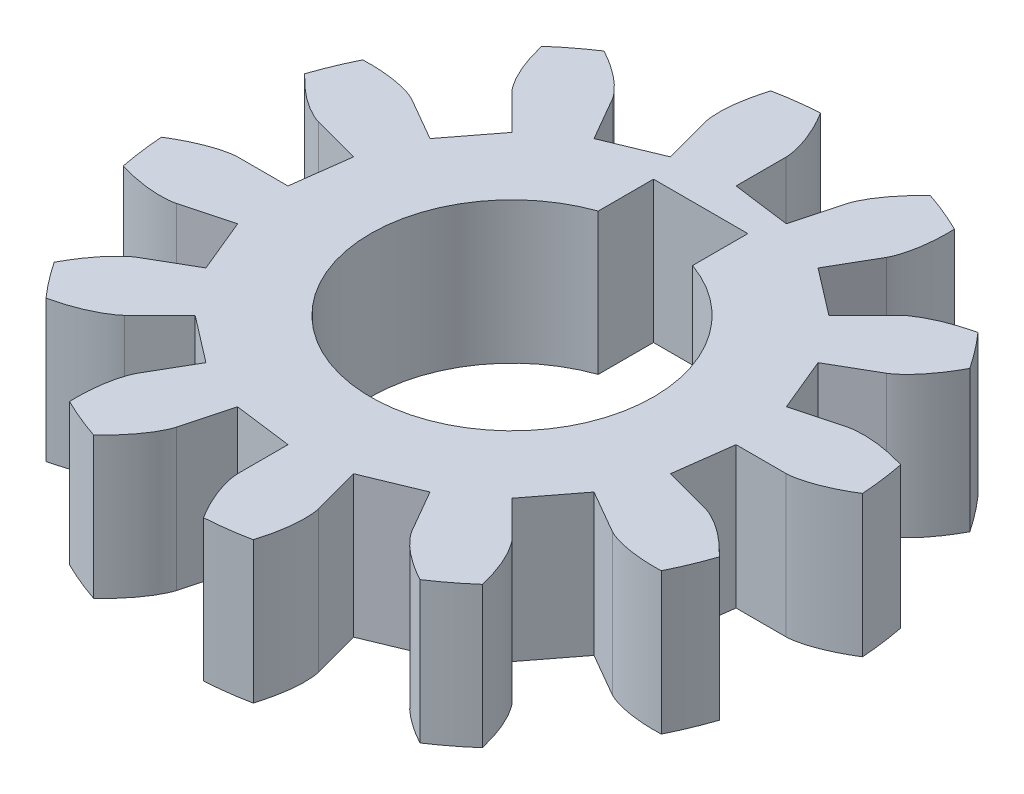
SolidWorks part; units mm, degrees
ref_plane "Front Plane" through (0, 0, 0) normal (0, 0, 1) x (1, 0, 0)
ref_plane "Top Plane" through (0, 0, 0) normal (0, 1, 0) x (1, 0, 0)
ref_plane "Right Plane" through (0, 0, 0) normal (1, 0, 0) x (0, 0, -1)
sketch "Sketch1" plane through (0, 0, 0) normal (0, 1, 0) x (1, 0, 0)
  line L0 (0, 0) -> (0, 2.9044) construction
  line L1 (0, 0) -> (-2.9044, 0) construction
  line L2 (0, 0) -> (-3.4701, -0.4568) construction
  line L3 (0, 0) -> (-2.8055, -0.7517) construction
  line L4 (0, 0) -> (-2.5153, -1.4522) construction
  circle A0 centre (0, 0) radius 3 construction
  circle A1 centre (0, 0) radius 2.9044 construction
  circle A2 centre (0, 0) radius 2.375 construction
  circle A3 centre (0, 0) radius 3.5 construction
  spline S0 degree 4 poles (-2.9044, 0) (-2.9111, 0) (-2.9296, -0.0007) (-2.9646, -0.0047) (-3.0211, -0.0149) (-3.0921, -0.0335) (-3.1821, -0.0638) (-3.2854, -0.1073) (-3.3957, -0.1631) (-3.5114, -0.2321) (-3.6229, -0.3081) (-3.7298, -0.3904) (-3.8324, -0.4779) (-3.9515, -0.5902) (-4.0871, -0.7336) (-4.2339, -0.9127) (-4.3862, -1.1288) (-4.525, -1.3614) (-4.6478, -1.5999) (-4.7551, -1.8504) (-4.847, -2.0993) (-4.9245, -2.3655) (-4.9869, -2.6153) (-5.0364, -2.9014) (-5.0704, -3.1344) (-5.0931, -3.4466) (-5.0999, -3.6323) (-5.1001, -3.8507) (-5.0962, -3.9482) (-5.0939, -4.0081) knots 0 0 0 0 0 0.005377 0.015084 0.028532 0.04661 0.064855 0.092111 0.119476 0.146842 0.174209 0.201575 0.228941 0.256307 0.307035 0.361767 0.4165 0.471232 0.525964 0.580697 0.635429 0.690161 0.744894 0.799626 0.854358 0.909091 0.954545 1 1 1 1 1 construction
  spline S1 degree 4 poles (-2.9044, 0) (-2.9111, 0) (-2.9296, -0.0007) (-2.9646, -0.0047) (-3.0211, -0.0149) (-3.0921, -0.0335) (-3.1821, -0.0638) (-3.2854, -0.1073) (-3.3957, -0.1631) (-3.5114, -0.2321) (-3.6229, -0.3081) (-3.7298, -0.3904) (-3.8324, -0.4779) (-3.9515, -0.5902) (-4.0871, -0.7336) (-4.2339, -0.9127) (-4.3862, -1.1288) (-4.525, -1.3614) (-4.6478, -1.5999) (-4.7551, -1.8504) (-4.847, -2.0993) (-4.9245, -2.3655) (-4.9869, -2.6153) (-5.0364, -2.9014) (-5.0704, -3.1344) (-5.0882, -3.3789) (-5.0943, -3.4984) (-5.0963, -3.5597) knots 0 0 0 0 0 0.005377 0.015084 0.028532 0.04661 0.064855 0.092111 0.119476 0.146842 0.174209 0.201575 0.228941 0.256307 0.307035 0.361767 0.4165 0.471232 0.525964 0.580697 0.635429 0.690161 0.744894 0.799626 0.854358 0.909091 0.909091 0.909091 0.909091 0.909091
  dimension "D1" = 7
  dimension "D2" = 6
  dimension "D3" = 5.8089
  dimension "D4" = 4.75
  dimension "D5" = 2.9044
  dimension "D6" = 7.5
  dimension "D7" = 15
  dimension "D8" = 30
sketch "Sketch2" plane through (0, 0, 0) normal (0, 1, 0) x (1, 0, 0)
  line L0 (0, 0) -> (-3.4701, -0.4568) construction
  line L1 (0, 0) -> (-3.4701, -0.4568) construction
  line L2 (0, 0) -> (-2.8055, -0.7517) construction
  line L3 (0, 0) -> (-2.9044, 0) construction
  line L4 (0, 0) -> (-2.5153, -1.4522) construction
  line L5 (0, 0) -> (-2.8055, -0.7517) construction
  line L6 (0, 0) -> (-2.9044, 0) construction
  line L7 (0, 0) -> (-2.5153, -1.4522) construction
  line L8 (-2.8055, -0.7517) -> (-2.2941, -0.6147)
  line L9 (-2.2941, -0.6147) -> (-2.0568, -1.1875)
  line L10 (-2.0568, -1.1875) -> (-2.5153, -1.4522) construction
  line L11 (-2.0568, -1.1875) -> (-1.299, -0.75)
  line L12 (-2.9044, 0) -> (-1.5, 0)
  circle A0 centre (0, 0) radius 2.375 construction
  circle A1 centre (0, 0) radius 2.9044 construction
  circle A2 centre (0, 0) radius 3 construction
  circle A3 centre (0, 0) radius 3.5 construction
  circle A4 centre (0, 0) radius 2.375 construction
  circle A5 centre (0, 0) radius 2.9044 construction
  circle A6 centre (0, 0) radius 3 construction
  circle A7 centre (0, 0) radius 3.5 construction
  arc A8 (-3.4315, -0.6892) -> (-3.4929, -0.2224) centre (0, 0) cw
  circle A11 centre (0, 0) radius 1.5 construction
  arc A12 (-1.5, 0) -> (-1.299, -0.75) centre (0, 0) ccw
  spline S0 degree 4 poles (-34.1117, -999.5091) (-1.7323, -18.0791) (-1.8596, -0.3555) (-2.4728, 0.0848) (-3.0211, -0.0149) (-3.0921, -0.0335) (-3.1821, -0.0638) (-3.2854, -0.1073) (-3.3957, -0.1631) (-3.5114, -0.2321) (-3.6229, -0.3081) (-3.7298, -0.3904) (-3.8324, -0.4779) (-3.9515, -0.5902) (-4.0871, -0.7336) (-4.2339, -0.9127) (-4.3862, -1.1288) (-4.525, -1.3614) (-4.6478, -1.5999) (-4.7551, -1.8504) (-4.847, -2.0993) (-4.9245, -2.3655) (-4.9869, -2.6153) (-5.0364, -2.9014) (-5.1901, -3.9552) (-5.0858, -7.216) (-3.5431, 26.5273) (-37.2414, -1003.0309) knots -0.405639 -0.405639 -0.405639 -0.405639 -0.405639 0.005377 0.015084 0.028532 0.04661 0.064855 0.092111 0.119476 0.146842 0.174209 0.201575 0.228941 0.256307 0.307035 0.361767 0.4165 0.471232 0.525964 0.580697 0.635429 0.690161 0.744894 0.799626 0.854358 1.680403 1.680403 1.680403 1.680403 1.680403 only from (-2.9044, 0) to (-5.0963, -3.5597) construction
  spline S1 degree 4 poles (-2.9044, 0) (-2.9111, 0) (-2.9296, -0.0007) (-2.9646, -0.0047) (-3.0211, -0.0149) (-3.0921, -0.0335) (-3.1821, -0.0638) (-3.2854, -0.1073) (-3.376, -0.1531) (-3.4444, -0.1925) (-3.483, -0.2163) (-3.4929, -0.2224) knots 0 0 0 0 0 0.005377 0.015084 0.028532 0.04661 0.064855 0.092111 0.119476 0.128939 0.128939 0.128939 0.128939 0.128939
  spline S2 degree 4 poles (-2.8055, -0.7517) (-2.8119, -0.7534) (-2.83, -0.7576) (-2.8648, -0.7628) (-2.922, -0.7675) (-2.9954, -0.7679) (-3.0901, -0.7619) (-3.2012, -0.7467) (-3.3006, -0.7259) (-3.3769, -0.7055) (-3.4203, -0.6926) (-3.4315, -0.6892) knots 0 0 0 0 0 0.005377 0.015084 0.028532 0.04661 0.064855 0.092111 0.119476 0.128939 0.128939 0.128939 0.128939 0.128939
  point P21 (-2.2941, -0.6147)
  point P24 (-2.0568, -1.1875)
  dimension "D2" = 3
extrude "Boss-Extrude1" add sketch "Sketch2" along normal blind 1.5
pattern_circular "CirPattern1" count 12 over 360 of "Boss-Extrude1"
sketch "Sketch3" plane through (0, 1.5, 0) normal (0, 1, 0) x (1, 0, 0)
  line L1 (0.5, 1) -> (-0.5, 1)
  line L2 (0.5, 1) -> (0.5, 2)
  line L3 (0.5, 2) -> (-0.5, 2)
  line L4 (-0.5, 1) -> (-0.5, 2)
  line L5 (0.5, 1) -> (-0.5, 2) construction
  line L6 (0.5, 2) -> (-0.5, 1) construction
  circle A0 centre (0, 0) radius 1.5 construction
  point P0 (0, 1.5)
  dimension "D1" = 1
  dimension "D2" = 1
extrude "Cut-Extrude1" cut sketch "Sketch3" against normal up to surface (1.5 mm away)
equation "\"Module\"= .5"
equation "\"Number of Teeth\" = 12"
equation "\"Pressure Angle\"= 14.5deg"
equation "\"Pitch Diameter\"= \"Number of Teeth\" * \"Module\""
equation "\"Circular Pitch\"= pi * \"Module\""
equation "\"Addendum\"= \"Module\""
equation "\"Dedendum\"= 1.25 * \"Module\""
equation "\"Base Diameter\"= \"Pitch Diameter\" * cos ( \"Pressure Angle\" )"
equation "\"Base Radius\"= \"Base Diameter\" / 2"
equation "\"Width\"= 1.5"
equation "\"Outside Diameter\"= \"Pitch Diameter\" + 2 * \"Addendum\""
equation "\"D1@Sketch1\"=\"Outside Diameter\""
equation "\"D3@Sketch1\"=\"Base Diameter\""
equation "\"Root Diameter\"= \"Pitch Diameter\" - 2 * \"Dedendum\""
equation "\"D4@Sketch1\"=\"Root Diameter\""
equation "\"Tooth Angle\"= 360 / \"Number of Teeth\""
equation "\"D6@Sketch1\"=\"Tooth Angle\"/4"
equation "\"D7@Sketch1\"=\"Tooth Angle\"/2"
equation "\"D8@Sketch1\"=\"Tooth Angle\""
equation "\"D2@Sketch1\" = \"Pitch Diameter\""
equation "\"Shaft Diameter\"= 3"
equation "\"D1@CirPattern1\" = \"Number of Teeth\""
equation "\"D2@Sketch2\"= \"Shaft Diameter\""
equation "\"D1@Boss-Extrude1\" = \"Width\""
